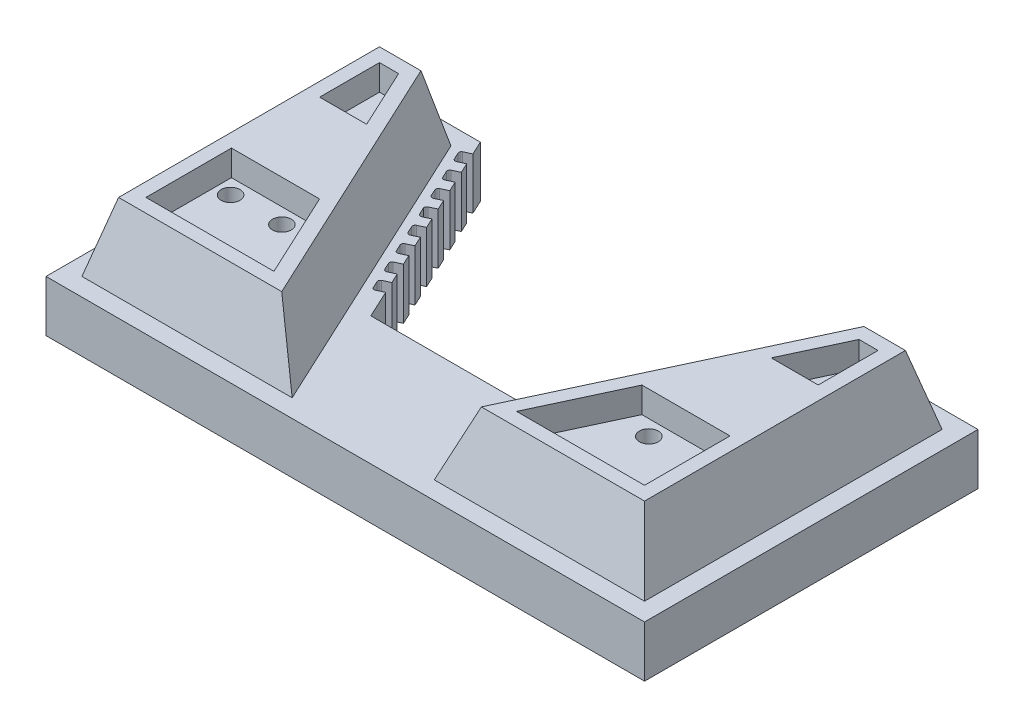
SolidWorks part; units mm, degrees
ref_plane "Front" through (0, 0, 0) normal (0, 0, 1) x (1, 0, 0)
ref_plane "Top" through (0, 0, 0) normal (0, 1, 0) x (1, 0, 0)
ref_plane "Right" through (0, 0, 0) normal (1, 0, 0) x (0, 0, -1)
sketch "Sketch1" plane through (0, 0, 0) normal (0, 1, 0) x (1, 0, 0)
  line L0 (0, 750) -> (0, 1604.6776) construction
  line L1 (0, 750) -> (0, 0)
  line L3 (0, 0) -> (1750, 0)
  line L4 (1750, 1950) -> (1750, 0)
  line L5 (0, 750) -> (600.4308, 750)
  line L6 (600.4308, 750) -> (1160, 1950)
  line L8 (1160, 1950) -> (1750, 1950)
  dimension "D1" = 590
  dimension "D2" = 1950
  dimension "D3" = 750
  dimension "D4" = 65
  dimension "D5" = 3500
extrude "Boss-Extrude1" add sketch "Sketch1" along normal blind 300
sketch "Sketch3" plane through (0, 300, 0) normal (0, 1, 0) x (1, 0, 0)
  line L12 (1645, 105) -> (1645, 1845)
  line L13 (1645, 1845) -> (1226.8924, 1845)
  line L14 (1226.8924, 1845) -> (667.3232, 645)
  line L15 (667.3232, 645) -> (105, 645)
  line L16 (105, 645) -> (105, 105)
  line L17 (105, 105) -> (1645, 105)
  line L18 (1645, 105) -> (1645, 1845)
  line L19 (1645, 1845) -> (1226.8924, 1845)
  line L20 (1226.8924, 1845) -> (415.5171, 105)
  line L23 (415.5171, 105) -> (1645, 105)
  dimension "D1" = 105
extrude "Boss-Extrude2" add sketch "Sketch3" along normal blind 400 draft 15
sketch "Sketch4" plane through (0, 700, 0) normal (0, 1, 0) x (1, 0, 0)
  line L4 (942.4841, 792.1797) -> (1457.8203, 792.1797)
  line L5 (1182.9313, 1307.8203) -> (1457.8203, 1307.8203)
  line L6 (1457.8203, 1307.8203) -> (1457.8203, 1657.8203)
  line L7 (942.4841, 792.1797) -> (709.3303, 292.1797)
  line L8 (709.3303, 292.1797) -> (1457.8203, 292.1797)
  line L9 (1457.8203, 292.1797) -> (1457.8203, 1657.8203)
  line L10 (1457.8203, 1657.8203) -> (1346.139, 1657.8203)
  line L11 (1346.139, 1657.8203) -> (709.3303, 292.1797)
  line L12 (709.3303, 292.1797) -> (1457.8203, 292.1797)
  line L13 (1457.8203, 292.1797) -> (1457.8203, 792.1797)
  line L14 (1457.8203, 1657.8203) -> (1346.139, 1657.8203)
  line L15 (1346.139, 1657.8203) -> (1182.9313, 1307.8203)
  dimension "D2" = 350
  dimension "D3" = 500
  dimension "D1" = 80
extrude "Cut-Extrude1" cut sketch "Sketch4" against normal blind 150
sketch "Sketch5" plane through (0, 300, 0) normal (0, 1, 0) x (1, 0, 0)
  line L0 (1121.9644, 1868.4323) -> (1176.3428, 1843.0752)
  line L1 (1160, 1950) -> (600.4308, 750) construction
  line L2 (1176.3428, 1843.0752) -> (1144.6465, 1775.1021)
  line L3 (1144.6465, 1775.1021) -> (1090.268, 1800.4592)
  line L4 (1090.268, 1800.4592) -> (1121.9644, 1868.4323)
  dimension "D1" = 60
  dimension "D2" = 90
  dimension "D3" = 75
extrude "Cut-Extrude2" cut sketch "Sketch5" against normal through all
fillet "Fillet1" radius 15 2 edges at (1144.6465, 150, -1775.1021) (1176.3428, 150, -1843.0752)
pattern_linear "LPattern1" count 8 spacing 140 along (-0.4226, 0, 0.9063) of "Cut-Extrude2", "Fillet1"
sketch "Sketch6" plane through (0, 550, 0) normal (0, 1, 0) x (1, 0, 0)
  line L0 (1372.8203, 702.1797) -> (1372.8203, 382.1797) construction
  line L1 (922.8203, 382.1797) -> (922.8203, 292.1797) construction
  line L3 (1457.8203, 292.1797) -> (1457.8203, 792.1797) construction
  line L5 (1372.8203, 702.1797) -> (1072.8203, 702.1797) construction
  line L6 (1372.8203, 382.1797) -> (922.8203, 382.1797) construction
  line L7 (709.3303, 292.1797) -> (1457.8203, 292.1797) construction
  line L8 (1457.8203, 792.1797) -> (942.4841, 792.1797) construction
  line L9 (709.3303, 292.1797) -> (1457.8203, 292.1797) construction
  line L10 (1372.8203, 382.1797) -> (1372.8203, 292.1797) construction
  circle A0 centre (1372.8203, 702.1797) radius 55
  circle A1 centre (1372.8203, 382.1797) radius 55
  circle A4 centre (1072.8203, 702.1797) radius 55
  circle A5 centre (922.8203, 382.1797) radius 55
  dimension "D1" = 110
  dimension "D2" = 90
  dimension "D3" = 320
  dimension "D4" = 85
  dimension "D5" = 300
  dimension "D6" = 450
extrude "Cut-Extrude3" cut sketch "Sketch6" against normal blind 150
mirror "Mirror1" about plane through (0, 0, 0) normal (1, 0, 0)
equation "\"mass_in_kg\"= ( \"SW-Mass\" / 1000 )'Wheight in kg"
